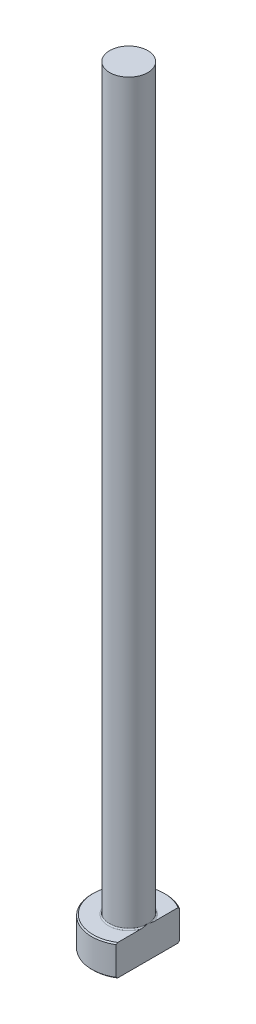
SolidWorks part; units mm, degrees
ref_plane "Front Plane" through (0, 0, 0) normal (0, 0, 1) x (1, 0, 0)
ref_plane "Top Plane" through (0, 0, 0) normal (0, 1, 0) x (1, 0, 0)
ref_plane "Right Plane" through (0, 0, 0) normal (1, 0, 0) x (0, 0, -1)
sketch "Sketch1" plane through (0, 0, 0) normal (0, 0, 1) x (1, 0, 0)
  line L0 (0, 259.9588) -> (0, -15.1925) construction
  line L1 (0, 0) -> (-6, 0)
  line L2 (-6, 0) -> (-6, 5)
  line L3 (-6, 5) -> (-3.1, 5)
  line L4 (-3.1, 5) -> (-3.1, 125)
  line L5 (-3.1, 125) -> (0, 125)
  line L6 (0, 125) -> (0, 0)
  dimension "L" = 125
  dimension "H" = 12
  dimension "T" = 5
  dimension "D" = 6.2
revolve "Revolve1" add sketch "Sketch1" angle 360 about L0
chamfer "Chamfer1" distance 0.2 angle 45 2 edges at (0, 5, 6) (0, 0, 6)
fillet "Fillet1" radius 0.2 1 edges at (0, 5, 3.1)
sketch "Sketch2" plane through (0, 0, 0) normal (0, 1, 0) x (1, 0, 0)
  line L0 (3.1, 5.1371) -> (3.1, -5.1371)
  circle A0 centre (0, 0) radius 6 construction
  arc A1 (3.1, -5.1371) -> (3.1, 5.1371) centre (0, 0) ccw
  circle A2 centre (0, 0) radius 3.1 construction
extrude "KEY" cut sketch "Sketch2" along normal through all
